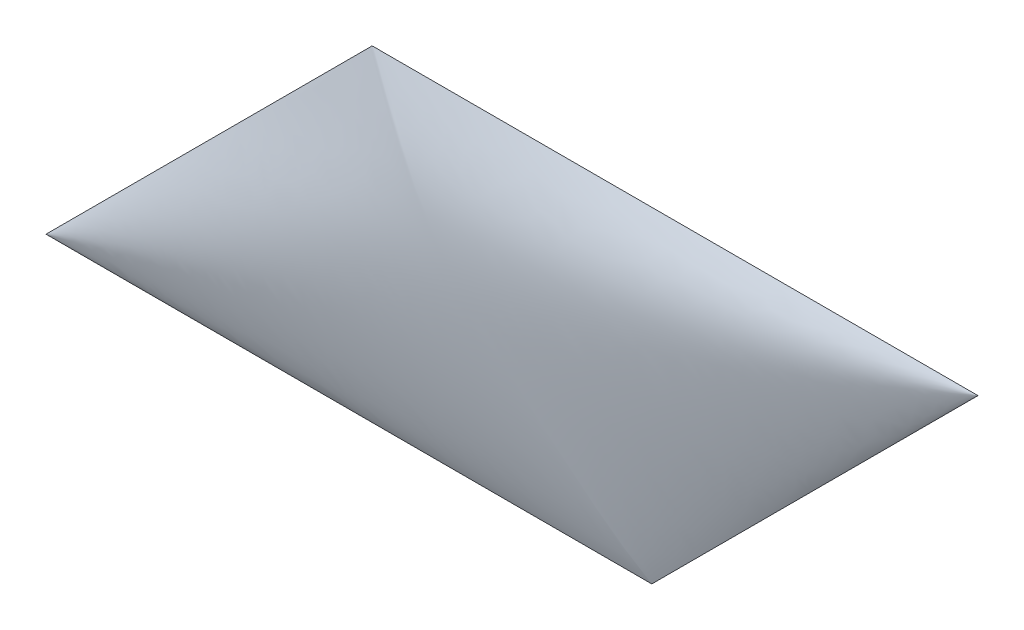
SolidWorks part; units mm, degrees
ref_plane "Ebene vorne" through (0, 0, 0) normal (0, 0, 1) x (1, 0, 0)
ref_plane "Ebene oben" through (0, 0, 0) normal (0, 1, 0) x (1, 0, 0)
ref_plane "Ebene rechts" through (0, 0, 0) normal (1, 0, 0) x (0, 0, -1)
sketch "Skizze1" plane through (0, 0, 0) normal (0, 0, 1) x (1, 0, 0)
  line L0 (0, 0) -> (650, 0)
  line L1 (350, 350) -> (1000, 350)
  line L2 (0, 0) -> (350, 350)
  line L3 (650, 0) -> (1000, 350)
  line L4 (0, 350) -> (650, 350) construction
  line L5 (0, 0) -> (1000, 350) construction
  line L6 (350, 350) -> (650, 0) construction
  line L7 (414.9533, 0) -> (776.5636, 126.5636) construction
  line L8 (223.4364, 223.4364) -> (585.0467, 350) construction
  line L9 (224.1178, 224.1178) -> (416.2187, 0) construction
  line L10 (-45.2844, 129.3841) -> (954.7156, 479.3841) construction
  line L11 (45.2844, -129.3841) -> (1045.2844, 220.6159) construction
  line L12 (583.7813, 350) -> (775.8822, 125.8822) construction
  line L14 (484.768, 465.5155) -> (784.768, 115.5155) construction
  line L15 (215.232, 234.4845) -> (515.232, -115.5155) construction
  dimension "D1" = 650
  dimension "D3" = 45
  dimension "D2" = 350
  dimension "D4" = 137.08
  dimension "D5" = 137.08
  dimension "D6" = 177.5
  dimension "D7" = 177.5
surface "Oberfläche-Ebene2" sketch "Skizze1"
ref_plane "Ebene1" through (0, 0, 0) normal (0.3304, -0.9439, 0) x (0.9439, 0.3304, 0)
sketch3d "3D-Skizze23"
  point P0 (0, 0, 0)
sketch3d "3D-Skizze30"
  line L0 (0, 0, 0) -> (223.4364, 223.4364, 0)
sketch3d "3D-Skizze31"
  line L0 (0, 0, 0) -> (414.9533, 0, 0)
sketch "Skizze3" plane through (0, 0, 0) normal (0.3304, -0.9439, 0) x (0.9439, 0.3304, 0)
  line L1 (529.7405, 30) -> (529.7405, 0) construction
  line L3 (0, 0) -> (1059.481, 0) construction
  arc A1 (0, 0) -> (1059.481, 0) centre (529.7405, -4662.0833) cw
  dimension "D1" = 30
sketch3d "3D-Skizze24"
  line L0 (0, 0, 0) -> (1000, 350, 0) construction
  line L1 (0, 0, 0) -> (1000, 350, 0)
ref_plane "Ebene2" through (374.7059, 321.1765, 0) normal (-0.7593, -0.6508, 0) x (0, 0, 1)
sketch "Skizze4" plane through (374.7059, 321.1765, 0) normal (-0.7593, -0.6508, 0) x (0, 0, 1)
  arc A1 (0, 37.9628) -> (0, -423.0144) centre (-870.4167, -192.5258) cw
sketch3d "3D-Skizze25"
  line L0 (350, 350, 0) -> (650, 0, 0) construction
  line L1 (350, 350, 0) -> (650, 0, 0)
ref_plane "Ebene3" through (45.2844, -129.3841, 0) normal (0.3304, -0.9439, 0) x (0.9439, 0.3304, 0)
sketch "Skizze10" plane through (45.2844, -129.3841, 0) normal (0.3304, -0.9439, 0) x (0.9439, 0.3304, 0)
  line L0 (583.2168, 17.8961) -> (583.2168, -69.22) construction
  arc A0 (391.6571, 0) -> (774.7764, 0) centre (583.2168, -1016.279) cw
  ellipse E0 centre (529.7405, -870.4167) end of major axis (529.7405, -1770.8333) minor radius 327.2422 (613.5079, 0) -> (445.9731, 0) ccw construction
sketch3d "3D-Skizze26"
  line L0 (414.9533, 0, 0) -> (776.5636, 126.5636, 0) construction
  line L1 (414.9533, 0, 0) -> (776.5636, 126.5636, 0)
ref_plane "Ebene4" through (-45.2844, 129.3841, 0) normal (0.3304, -0.9439, 0) x (0.9439, 0.3304, 0)
sketch "Skizze11" plane through (-45.2844, 129.3841, 0) normal (0.3304, -0.9439, 0) x (0.9439, 0.3304, 0)
  line L0 (476.2642, 17.8961) -> (476.2642, -69.5037) construction
  arc A0 (284.7046, 0) -> (667.8239, 0) centre (476.2642, -1016.279) cw
  ellipse E0 centre (529.7405, -870.4167) end of major axis (529.7405, -1770.8333) minor radius 327.2422 (613.5079, 0) -> (445.9731, 0) ccw construction
sketch3d "3D-Skizze27"
  line L0 (223.4364, 223.4364, 0) -> (585.0467, 350, 0) construction
  line L1 (223.4364, 223.4364, 0) -> (585.0467, 350, 0)
ref_plane "Ebene5" through (239.9378, 205.661, 0) normal (-0.7593, -0.6508, 0) x (0, 0, 1)
sketch "Skizze12" plane through (239.9378, 205.661, 0) normal (-0.7593, -0.6508, 0) x (0, 0, 1)
  line L0 (26.1301, -123.2813) -> (0, -123.2813) construction
  arc A0 (0, 24.309) -> (0, -270.8715) centre (-403.7513, -123.2813) cw
  ellipse E0 centre (-4662.0833, -192.5258) end of major axis (30, -192.5258) minor radius 1705.2632 (0, -385.0516) -> (0, 0) ccw construction
sketch3d "3D-Skizze28"
  line L0 (224.1178, 224.1178, 0) -> (416.2187, 0, 0) construction
  line L1 (224.1178, 224.1178, 0) -> (416.2187, 0, 0)
sketch3d "3D-Skizze33"
  arc A0 (0, 0, 0) -> (1000, 350, 0) centre (500, 175, -4662.0833) ccw construction
  arc A1 (0, 0, 0) -> (320.1682, 112.0589, 26.1301) centre (500, 175, -4662.0833) ccw
  point P3 (-1050.0317, 4603.6621, -4662.0833)
  point P4 (-1050.0317, 4603.6621, -4662.0833)
ref_plane "Ebene6" through (509.4739, 436.6919, 0) normal (-0.7593, -0.6508, 0) x (0, 0, 1)
sketch "Skizze13" plane through (509.4739, 436.6919, 0) normal (-0.7593, -0.6508, 0) x (0, 0, 1)
  line L0 (26.1301, -261.7703) -> (0, -261.7703) construction
  arc A0 (0, -114.18) -> (0, -409.3605) centre (-403.7513, -261.7703) cw
  ellipse E0 centre (-4662.0833, -192.5258) end of major axis (30, -192.5258) minor radius 1705.2632 (0, -385.0516) -> (0, 0) ccw construction
sketch3d "3D-Skizze29"
  line L0 (583.7813, 350, 0) -> (775.8822, 125.8822, 0) construction
  line L1 (583.7813, 350, 0) -> (775.8822, 125.8822, 0)
sketch3d "3D-Skizze20"
  line L0 (0, 0, 0) -> (350, 350, 0) construction
  line L1 (224.1178, 224.1178, 0) -> (350, 350, 0)
sketch3d "3D-Skizze21"
  line L0 (0, 0, 0) -> (650, 0, 0) construction
  line L1 (416.2187, 0, 0) -> (650, 0, 0)
sketch3d "3D-Skizze13"
  line L0 (650, 0, 0) -> (1000, 350, 0) construction
  line L1 (650, 0, 0) -> (775.8822, 125.8822, 0)
sketch3d "3D-Skizze12"
  line L0 (350, 350, 0) -> (1000, 350, 0) construction
  line L1 (350, 350, 0) -> (583.7813, 350, 0)
sketch3d "3D-Skizze34"
  point P0 (1000, 350, 0)
sketch3d "3D-Skizze35"
  line L0 (1000, 350, 0) -> (776.5636, 126.5636, 0)
sketch3d "3D-Skizze36"
  line L0 (1000, 350, 0) -> (585.0467, 350, 0)
sketch3d "3D-Skizze37"
  arc A0 (0, 0, 0) -> (1000, 350, 0) centre (500, 175, -4662.0833) ccw construction
  arc A1 (679.8318, 237.9411, 26.1301) -> (1000, 350, 0) centre (500, 175, -4662.0833) ccw
  point P3 (-1050.0317, 4603.6621, -4662.0833)
  point P4 (-1050.0317, 4603.6621, -4662.0833)
sketch3d "3D-Skizze39"
  arc A0 (414.9533, 0, 0) -> (776.5636, 126.5636, 0) centre (595.7585, 63.2818, -1016.279) ccw construction
  arc A1 (414.9533, 0, 0) -> (776.5636, 126.5636, 0) centre (595.7585, 63.2818, -1016.279) ccw
  point P3 (254.1183, 1039.3966, -1016.279)
  point P4 (254.1183, 1039.3966, -1016.279)
sketch3d "3D-Skizze40"
  arc A0 (223.4364, 223.4364, 0) -> (585.0467, 350, 0) centre (404.2415, 286.7182, -1016.279) ccw construction
  arc A1 (223.4364, 223.4364, 0) -> (585.0467, 350, 0) centre (404.2415, 286.7182, -1016.279) ccw
  point P3 (62.6014, 1262.8329, -1016.279)
  point P4 (62.6014, 1262.8329, -1016.279)
sketch3d "3D-Skizze41"
  arc A0 (350, 350, 0) -> (650, 0, 0) centre (500, 175, -870.4167) ccw construction
  arc A1 (404.2415, 286.7182, 17.8961) -> (595.7585, 63.2818, 17.8961) centre (500, 175, -870.4167) ccw
  point P3 (1183.6473, 760.9834, -870.4167)
  point P4 (1183.6473, 760.9834, -870.4167)
sketch3d "3D-Skizze43"
  arc A0 (583.7813, 350, 0) -> (775.8822, 125.8822, 0) centre (679.8318, 237.9411, -403.7513) ccw construction
  arc A1 (583.7813, 350, 0) -> (775.8822, 125.8822, 0) centre (679.8318, 237.9411, -403.7513) ccw
  point P3 (1006.2221, 517.7042, -403.7513)
  point P4 (1006.2221, 517.7042, -403.7513)
sketch3d "3D-Skizze45"
  arc A0 (0, 0, 0) -> (1000, 350, 0) centre (500, 175, -4662.0833) ccw construction
  arc A1 (320.1682, 112.0589, 26.1301) -> (679.8318, 237.9411, 26.1301) centre (500, 175, -4662.0833) ccw
  point P3 (-1050.0317, 4603.6621, -4662.0833)
  point P4 (-1050.0317, 4603.6621, -4662.0833)
sketch3d "3D-Skizze46"
  arc A0 (414.9533, 0, 0) -> (776.5636, 126.5636, 0) centre (595.7585, 63.2818, -1016.279) ccw construction
  arc A1 (414.9533, 0, 0) -> (776.5636, 126.5636, 0) centre (595.7585, 63.2818, -1016.279) ccw
  point P3 (254.1183, 1039.3966, -1016.279)
  point P4 (254.1183, 1039.3966, -1016.279)
sketch3d "3D-Skizze47"
  point P0 (650, 0, 0)
sketch3d "3D-Skizze48"
  line L0 (776.5636, 126.5636, 0) -> (650, 0, 0)
sketch3d "3D-Skizze49"
  line L0 (414.9533, 0, 0) -> (650, 0, 0)
sketch3d "3D-Skizze50"
  arc A0 (350, 350, 0) -> (650, 0, 0) centre (500, 175, -870.4167) ccw construction
  arc A1 (595.7585, 63.2818, 17.8961) -> (650, 0, 0) centre (500, 175, -870.4167) ccw
  point P3 (1183.6473, 760.9834, -870.4167)
  point P4 (1183.6473, 760.9834, -870.4167)
sketch3d "3D-Skizze51"
  arc A0 (223.4364, 223.4364, 0) -> (585.0467, 350, 0) centre (404.2415, 286.7182, -1016.279) ccw construction
  arc A1 (223.4364, 223.4364, 0) -> (585.0467, 350, 0) centre (404.2415, 286.7182, -1016.279) ccw
  point P3 (62.6014, 1262.8329, -1016.279)
  point P4 (62.6014, 1262.8329, -1016.279)
sketch3d "3D-Skizze52"
  point P0 (350, 350, 0)
sketch3d "3D-Skizze53"
  line L0 (585.0467, 350, 0) -> (350, 350, 0)
sketch3d "3D-Skizze54"
  line L0 (223.4364, 223.4364, 0) -> (350, 350, 0)
sketch3d "3D-Skizze55"
  arc A0 (350, 350, 0) -> (650, 0, 0) centre (500, 175, -870.4167) ccw construction
  arc A1 (350, 350, 0) -> (404.2415, 286.7182, 17.8961) centre (500, 175, -870.4167) ccw
  point P3 (1183.6473, 760.9834, -870.4167)
  point P4 (1183.6473, 760.9834, -870.4167)
sketch "Skizze16" [suppressed] plane through (0, 0, 0) normal (0, 0, -1) x (-1, 0, 0)
  line L8 (-584.414, 360.01) -> (-1024.1663, 360.01)
  line L9 (-1024.1663, 360.01) -> (-783.3011, 119.1448)
  line L10 (-783.3011, 119.1448) -> (-654.1463, -10.01)
  line L11 (-654.1463, -10.01) -> (-415.586, -10.01)
  line L12 (-415.586, -10.01) -> (24.1663, -10.01)
  line L13 (24.1663, -10.01) -> (-216.6989, 230.8552)
  line L14 (-216.6989, 230.8552) -> (-345.8537, 360.01)
  line L15 (-345.8537, 360.01) -> (-584.414, 360.01)
sketch3d "3D-Skizze56"
  arc A0 (350, 350, 0) -> (650, 0, 0) centre (500, 175, -870.4167) ccw construction
  arc A1 (404.2415, 286.7182, 17.8961) -> (595.7585, 63.2818, 17.8961) centre (500, 175, -870.4167) ccw
  point P3 (1183.6473, 760.9834, -870.4167)
  point P4 (1183.6473, 760.9834, -870.4167)
surface "Oberfläche-Ausformung1"
